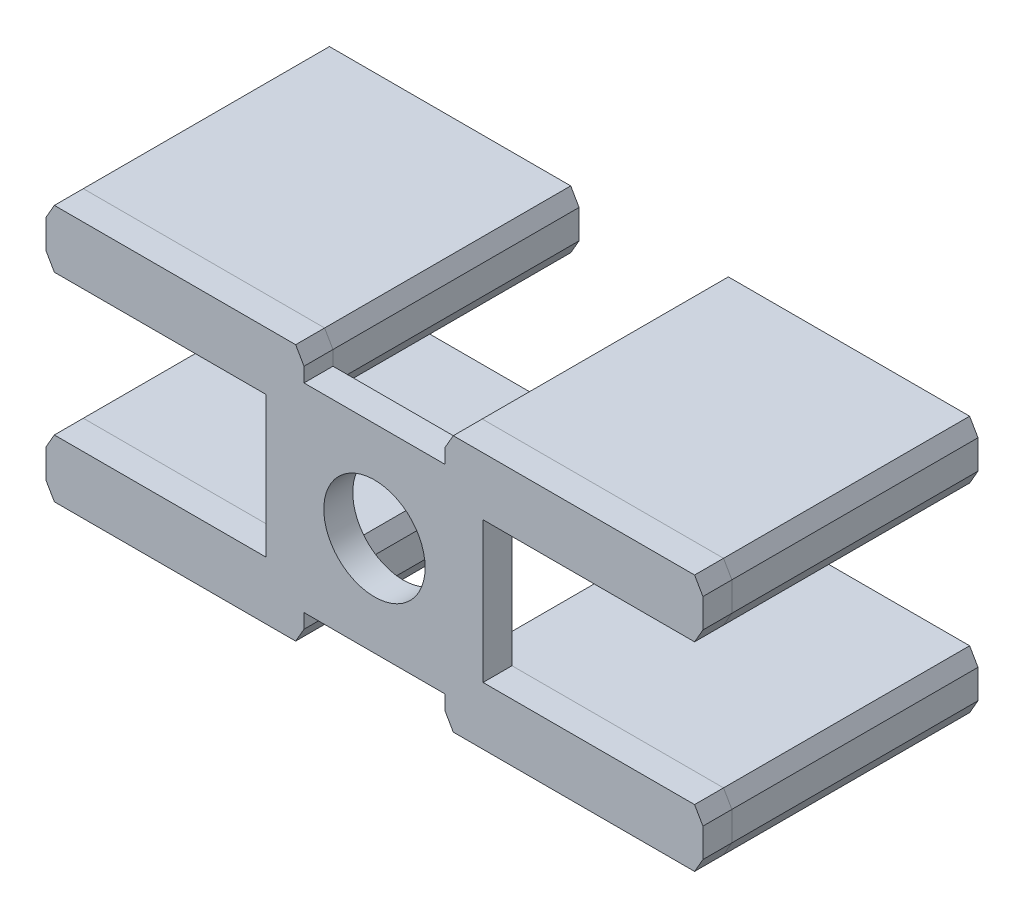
SolidWorks part; units mm, degrees
ref_plane "Top Plane" through (0, 0, 0) normal (0, 0, 1) x (1, 0, 0)
ref_plane "Front Plane" through (0, 0, 0) normal (0, 1, 0) x (1, 0, 0)
ref_plane "Right Plane" through (0, 0, 0) normal (1, 0, 0) x (0, 0, -1)
sketch "Sketch18" plane through (0, 0, 0) normal (0, 0, 1) x (1, 0, 0)
  line L0 (0, 47.7725) -> (0, -47.7725) construction
  line L1 (-77.5263, 0) -> (77.5263, 0) construction
  line L2 (-68.0641, 20.6) -> (-14.6, 20.6) construction
  line L3 (-66.3321, 26.6) -> (-16.3321, 26.6)
  line L4 (-66.3321, 14.6) -> (-16.3321, 14.6)
  line L5 (-41.3321, 20.6) -> (-41.3321, 26.6) construction
  line L6 (-41.3321, 20.6) -> (-41.3321, 14.6) construction
  line L7 (-68.0641, 23.6) -> (-68.0641, 17.6)
  line L8 (-14.6, 23.6) -> (-14.6, 17.6)
  line L9 (-66.3321, 14.6) -> (-68.0641, 17.6)
  line L10 (-66.3321, 26.6) -> (-68.0641, 23.6)
  line L11 (-16.3321, 26.6) -> (-14.6, 23.6)
  line L12 (-14.6, 17.6) -> (-16.3321, 14.6)
  line L13 (-41.3321, 14.6) -> (-41.3321, 0) construction
  line L14 (-14.6, 20.6) -> (0, 20.6) construction
  line L15 (41.3321, 20.6) -> (41.3321, 14.6) construction
  line L16 (41.3321, 20.6) -> (41.3321, 26.6) construction
  line L17 (68.0641, 20.6) -> (14.6, 20.6) construction
  line L18 (14.6, 17.6) -> (16.3321, 14.6)
  line L19 (16.3321, 26.6) -> (14.6, 23.6)
  line L20 (66.3321, 26.6) -> (68.0641, 23.6)
  line L21 (66.3321, 14.6) -> (68.0641, 17.6)
  line L22 (14.6, 23.6) -> (14.6, 17.6)
  line L23 (68.0641, 23.6) -> (68.0641, 17.6)
  line L24 (66.3321, 14.6) -> (16.3321, 14.6)
  line L25 (66.3321, 26.6) -> (16.3321, 26.6)
  line L26 (68.0641, -20.6) -> (14.6, -20.6) construction
  line L27 (41.3321, -20.6) -> (41.3321, -26.6) construction
  line L28 (41.3321, -20.6) -> (41.3321, -14.6) construction
  line L29 (66.3321, -26.6) -> (16.3321, -26.6)
  line L30 (66.3321, -14.6) -> (16.3321, -14.6)
  line L31 (68.0641, -23.6) -> (68.0641, -17.6)
  line L32 (14.6, -23.6) -> (14.6, -17.6)
  line L33 (66.3321, -14.6) -> (68.0641, -17.6)
  line L34 (66.3321, -26.6) -> (68.0641, -23.6)
  line L35 (16.3321, -26.6) -> (14.6, -23.6)
  line L36 (14.6, -17.6) -> (16.3321, -14.6)
  line L37 (-41.3321, -20.6) -> (-41.3321, -14.6) construction
  line L38 (-41.3321, -20.6) -> (-41.3321, -26.6) construction
  line L39 (-68.0641, -20.6) -> (-14.6, -20.6) construction
  line L40 (-14.6, -17.6) -> (-16.3321, -14.6)
  line L41 (-16.3321, -26.6) -> (-14.6, -23.6)
  line L42 (-66.3321, -26.6) -> (-68.0641, -23.6)
  line L43 (-66.3321, -14.6) -> (-68.0641, -17.6)
  line L44 (-14.6, -23.6) -> (-14.6, -17.6)
  line L45 (-68.0641, -23.6) -> (-68.0641, -17.6)
  line L46 (-66.3321, -14.6) -> (-16.3321, -14.6)
  line L47 (-66.3321, -26.6) -> (-16.3321, -26.6)
  point P4 (0, 0)
  point P8 (0, 0)
  point P16 (-41.3321, 20.6)
  point P22 (-68.0641, 20.6)
  point P24 (-14.6, 20.6)
  point P39 (14.6, 20.6)
  point P40 (68.0641, 20.6)
  point P41 (41.3321, 20.6)
  point P55 (41.3321, -20.6)
  point P56 (68.0641, -20.6)
  point P57 (14.6, -20.6)
  point P71 (-14.6, -20.6)
  point P72 (-68.0641, -20.6)
  point P73 (-41.3321, -20.6)
extrude "Boss-Extrude9" add sketch "Sketch18" along normal blind 51
sketch "Sketch19" plane through (0, 0, 51) normal (0, 0, 1) x (1, 0, 0)
  line L0 (-66.3321, 26.6) -> (-68.0641, 23.6) construction
  line L1 (-68.0641, 23.6) -> (-68.0641, 17.6) construction
  line L2 (-68.0641, 17.6) -> (-66.3321, 14.6) construction
  line L3 (-66.3321, 14.6) -> (-16.3321, 14.6) construction
  line L4 (-22.5, 14.6) -> (22.5, 14.6) construction
  line L5 (-14.6, 17.6) -> (-14.6, 23.6) construction
  line L6 (-14.6, 23.6) -> (-16.3321, 26.6) construction
  line L7 (-16.3321, 26.6) -> (-66.3321, 26.6) construction
  line L8 (14.6, 23.6) -> (14.6, 17.6) construction
  line L10 (16.3321, 14.6) -> (66.3321, 14.6) construction
  line L11 (66.3321, 14.6) -> (68.0641, 17.6) construction
  line L12 (68.0641, 17.6) -> (68.0641, 23.6) construction
  line L13 (68.0641, 23.6) -> (66.3321, 26.6) construction
  line L14 (66.3321, 26.6) -> (16.3321, 26.6) construction
  line L15 (16.3321, 26.6) -> (14.6, 23.6) construction
  line L16 (66.3321, -26.6) -> (68.0641, -23.6) construction
  line L17 (68.0641, -23.6) -> (68.0641, -17.6) construction
  line L18 (68.0641, -17.6) -> (66.3321, -14.6) construction
  line L19 (66.3321, -14.6) -> (16.3321, -14.6) construction
  line L21 (14.6, -17.6) -> (14.6, -23.6) construction
  line L22 (14.6, -23.6) -> (16.3321, -26.6) construction
  line L23 (16.3321, -26.6) -> (66.3321, -26.6) construction
  line L24 (-14.6, -23.6) -> (-14.6, -17.6) construction
  line L26 (-16.3321, -14.6) -> (-66.3321, -14.6) construction
  line L27 (-66.3321, -14.6) -> (-68.0641, -17.6) construction
  line L28 (-68.0641, -17.6) -> (-68.0641, -23.6) construction
  line L29 (-68.0641, -23.6) -> (-66.3321, -26.6) construction
  line L30 (-66.3321, -26.6) -> (-16.3321, -26.6) construction
  line L31 (-16.3321, -26.6) -> (-14.6, -23.6) construction
  line L32 (-66.3321, 26.6) -> (-68.0641, 23.6)
  line L33 (-68.0641, 23.6) -> (-68.0641, 17.6)
  line L34 (-68.0641, 17.6) -> (-66.3321, 14.6)
  line L35 (-66.3321, 14.6) -> (-22.5, 14.6)
  line L37 (-14.6, 20.6) -> (-14.6, 23.6)
  line L38 (-14.6, 23.6) -> (-16.3321, 26.6)
  line L39 (-16.3321, 26.6) -> (-66.3321, 26.6)
  line L40 (14.6, 23.6) -> (14.6, 20.6)
  line L42 (22.5, 14.6) -> (66.3321, 14.6)
  line L43 (66.3321, 14.6) -> (68.0641, 17.6)
  line L44 (68.0641, 17.6) -> (68.0641, 23.6)
  line L45 (68.0641, 23.6) -> (66.3321, 26.6)
  line L46 (66.3321, 26.6) -> (16.3321, 26.6)
  line L47 (16.3321, 26.6) -> (14.6, 23.6)
  line L48 (66.3321, -26.6) -> (68.0641, -23.6)
  line L49 (68.0641, -23.6) -> (68.0641, -17.6)
  line L50 (68.0641, -17.6) -> (66.3321, -14.6)
  line L51 (66.3321, -14.6) -> (22.5, -14.6)
  line L53 (14.6, -20.6) -> (14.6, -23.6)
  line L54 (14.6, -23.6) -> (16.3321, -26.6)
  line L55 (16.3321, -26.6) -> (66.3321, -26.6)
  line L56 (-14.6, -23.6) -> (-14.6, -20.6)
  line L58 (-22.5, -14.6) -> (-66.3321, -14.6)
  line L59 (-66.3321, -14.6) -> (-68.0641, -17.6)
  line L60 (-68.0641, -17.6) -> (-68.0641, -23.6)
  line L61 (-68.0641, -23.6) -> (-66.3321, -26.6)
  line L62 (-66.3321, -26.6) -> (-16.3321, -26.6)
  line L63 (-16.3321, -26.6) -> (-14.6, -23.6)
  line L64 (-22.5, 14.6) -> (-22.5, -14.6)
  line L65 (22.5, 14.6) -> (22.5, -14.6)
  line L66 (-14.6, 20.6) -> (14.6, 20.6)
  line L67 (-14.6, -20.6) -> (14.6, -20.6)
  line L68 (-10.5, 55.1356) -> (-10.5, -55.1356) construction
  line L69 (10.5, 52.0307) -> (10.5, -52.0307) construction
  line L70 (-22.5, -14.6) -> (22.5, -14.6) construction
  line L71 (-14.6, 20.6) -> (-14.6, 14.6) construction
  line L72 (-14.6, -20.6) -> (-14.6, -14.6) construction
  line L73 (14.6, -20.6) -> (14.6, -14.6) construction
  line L74 (14.6, 20.6) -> (14.6, 14.6) construction
  line L75 (-14.6, 20.6) -> (-14.6, 26.6) construction
  line L76 (16.3321, 26.6) -> (-16.3321, 26.6) construction
  circle A0 centre (0, 0) radius 10.5
  point P29 (-10.5, 0)
  point P35 (10.5, 0)
  point P36 (0, 0)
  point P43 (-10.5, -16.1)
  point P45 (-10.5, 0)
  point P47 (10.5, 0)
extrude "Boss-Extrude10" add sketch "Sketch19" along normal blind 6 separate body
equation "\"bore-id\"= 15mm"
equation "\"wall-thickness\"= 6mm"
equation "\"wall-depth\"= 4mm"
equation "\"bolt-size\"= 4.2mm"
equation "\"jaw-spread\"= 52mm"
equation "\"jaw-width\"= 25.2mm"
equation "\"jaw-distance\"= 57"
equation "\"radius\"= 5mm"
equation "\"jaw-depth\"= 25mm"
equation "\"jaw-clearance\"= 2mm"
equation "\"D5@Sketch18\"= \"jaw-width\" / 2 + \"jaw-clearance\" + \"bore-clearance\""
equation "\"D6@Sketch18\"=\"wall-thickness\"*2"
equation "\"D1@Boss-Extrude9\"= \"jaw-distance\" - \"wall-thickness\""
equation "\"bore-clearance\"= 0"
equation "\"D1@Sketch19\"=\"bore-id\"+\"wall-thickness\""
equation "\"D3@Sketch19\" = \"wall-thickness\" * 2"
equation "\"D4@Sketch19\"= \"wall-thickness\" * 2"
equation "\"D1@Boss-Extrude10\"= \"wall-thickness\""
